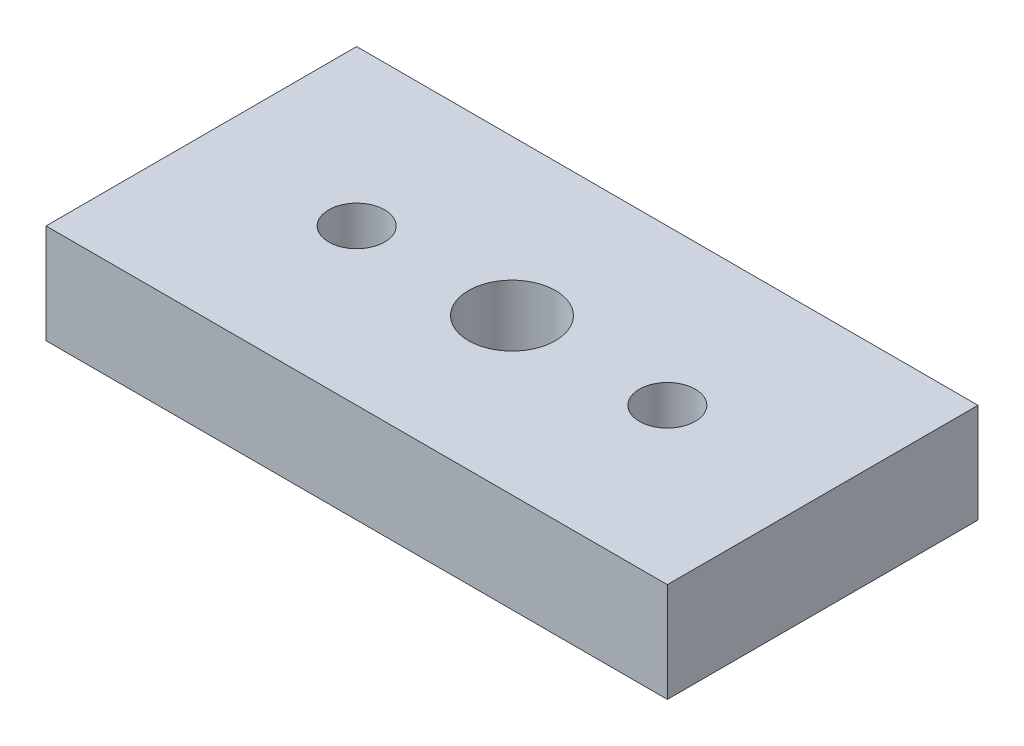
SolidWorks part; units mm, degrees
ref_plane "正面" through (0, 0, 0) normal (0, 0, 1) x (1, 0, 0)
ref_plane "平面" through (0, 0, 0) normal (0, 1, 0) x (1, 0, 0)
ref_plane "右側面" through (0, 0, 0) normal (1, 0, 0) x (0, 0, -1)
sketch "ｽｹｯﾁ1" plane through (0, 0, 0) normal (0, 1, 0) x (1, 0, 0)
  line L1 (-50, 25) -> (50, 25)
  line L2 (-50, 25) -> (-50, -25)
  line L3 (-50, -25) -> (50, -25)
  line L4 (50, 25) -> (50, -25)
  point P0 (-50, 25)
  point P1 (50, -25)
  point P2 (-50, -25)
  point P3 (50, 25)
  dimension "D1" = 100
  dimension "D2" = 50
  dimension "D3" = 25
  dimension "D4" = 50
extrude "押し出し1" add sketch "ｽｹｯﾁ1" along normal blind 16
hole_wizard "M16x2.0 ねじ穴1" positions "3Dｽｹｯﾁ1" profile "ｽｹｯﾁ2" tap size "M16x2.0" standard "JIS"
sketch3d "3Dｽｹｯﾁ1"
  line L0 (-50, 16, -25) -> (-50, 16, 25) construction
  line L1 (50, 16, -25) -> (-50, 16, -25) construction
  point P0 (0, 16, 0)
  dimension "D1" = 50
  dimension "D2" = 25
sketch "ｽｹｯﾁ2" plane through (0, 16, 0) normal (1, 0, 0) x (0, 0, 1)
  line L0 (0, 0) -> (0, 16)
  line L1 (0, 16) -> (7, 16)
  line L2 (7, 16) -> (7, 0)
  line L5 (7, 0) -> (0, 0)
  line L11 (0, -6.35) -> (0, 107.95) construction
  dimension "次ｻｰﾌｪｽまでのねじ下穴ﾄﾞﾘﾙの直径" = 14
  dimension "次ｻｰﾌｪｽまでのねじ下穴ﾄﾞﾘﾙの深さ" = 16
hole_wizard "M8 穴付きねじ用座ぐり穴1" positions "ｽｹｯﾁ10" profile "ｽｹｯﾁ9" counterbore size "M8" standard "JIS"
sketch "ｽｹｯﾁ10" plane through (-19.4332, 0, 12.3043) normal (0, 1, 0) x (-1, 0, 0)
  line L0 (30.5668, -37.3043) -> (30.5668, 12.6957) construction
  line L1 (30.5668, 12.6957) -> (-69.4332, 12.6957) construction
  point P0 (5.5668, -12.3043)
  point P1 (-44.4332, -12.3043)
  dimension "D1" = 25
  dimension "D2" = 50
  dimension "D3" = 25
  dimension "D4" = 25
sketch "ｽｹｯﾁ9" plane through (-25, 0, 0) normal (1, 0, 0) x (0, 0, -1)
  line L0 (0, 0) -> (0, 16)
  line L1 (0, 16) -> (4.5, 16)
  line L3 (4.5, 16) -> (4.5, 8.6)
  line L4 (4.5, 8.6) -> (7, 8.6)
  line L5 (7, 8.6) -> (7, 0)
  line L7 (7, 0) -> (0, 0)
  line L11 (0, -6.35) -> (0, 107.95) construction
  dimension "通し穴の直径" = 9
  dimension "通し穴の深さ" = 16
  dimension "座ぐり穴の直径" = 14
  dimension "座ぐり穴の深さ" = 8.6
